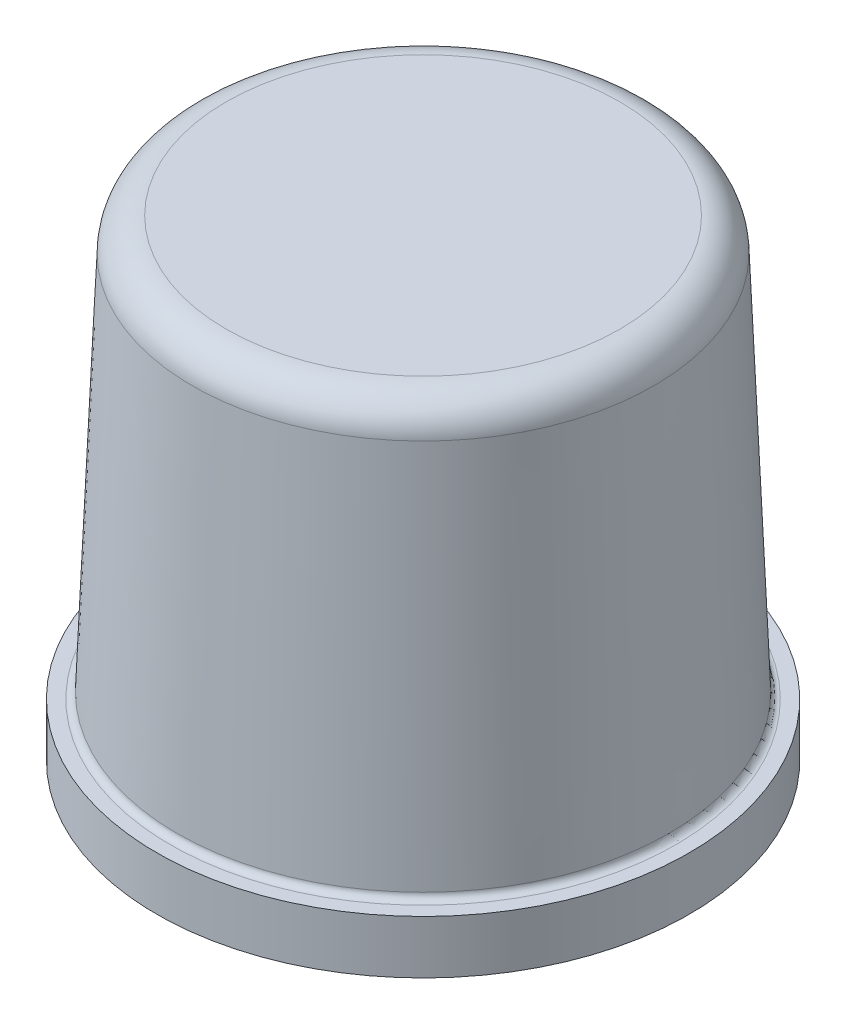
SolidWorks part; units mm, degrees
ref_plane "Plan de face" through (0, 0, 0) normal (0, 0, 1) x (1, 0, 0)
ref_plane "Plan de dessus" through (0, 0, 0) normal (0, 1, 0) x (1, 0, 0)
ref_plane "Plan de droite" through (0, 0, 0) normal (1, 0, 0) x (0, 0, -1)
sketch "Esquisse1" plane through (0, 0, 0) normal (0, 0, 1) x (1, 0, 0)
  line L0 (0, 0) -> (0, 70) construction
  line L1 (0, 0) -> (-39.5, 0)
  line L2 (-39.5, 0) -> (-39.5, 7.9)
  line L3 (-39.5, 7.9) -> (-37.4606, 7.9)
  line L4 (-36.4614, 8.8598) -> (-34.1932, 65.2011)
  line L5 (-29.1972, 70) -> (0, 70)
  line L6 (0, 0) -> (0, 70)
  arc A0 (-34.1932, 65.2011) -> (-29.1972, 70) centre (-29.1972, 65) cw
  arc A1 (-37.4606, 7.9) -> (-36.4614, 8.8598) centre (-37.4606, 8.9) ccw
  point P9 (-34, 70)
  point P12 (-36.5, 7.9)
  dimension "D6" = 5
  dimension "D7" = 1
  dimension "D1" = 7.9
  dimension "D2" = 79
  dimension "D3" = 73
  dimension "D4" = 68
  dimension "D5" = 70
revolve "Révolution1" add sketch "Esquisse1" angle 360 about L0
shell "Coque1" thickness 2
